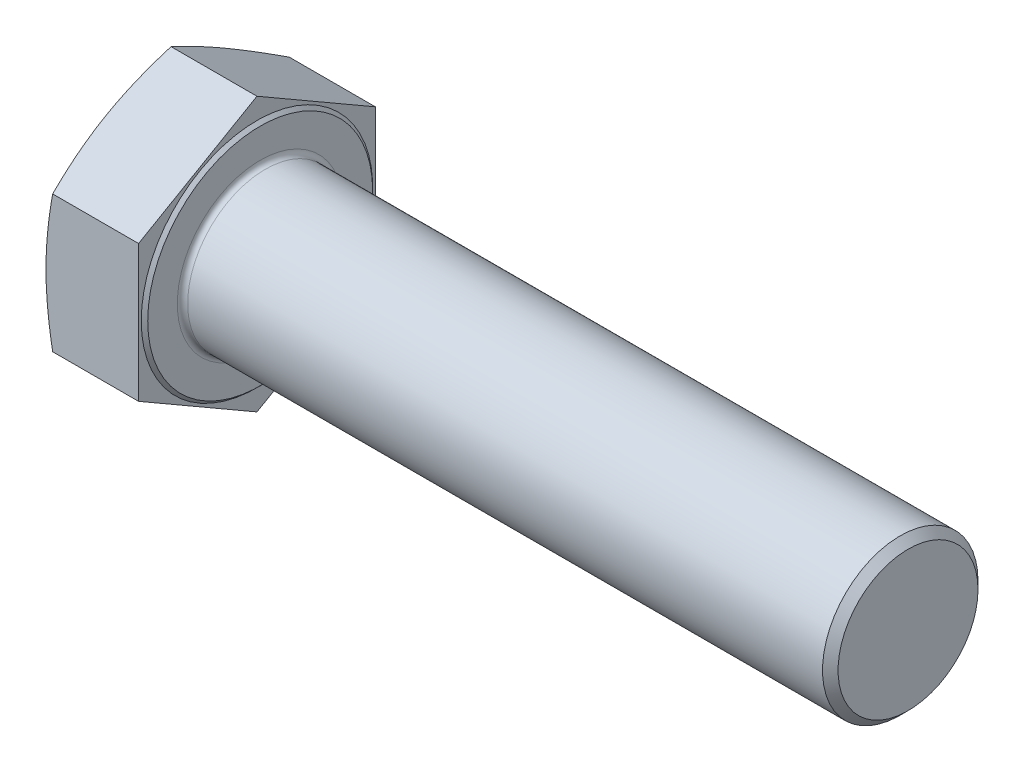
SolidWorks part; units mm, degrees
ref_plane "Front" through (0, 0, 0) normal (0, 0, 1) x (1, 0, 0)
ref_plane "Top" through (0, 0, 0) normal (0, 1, 0) x (1, 0, 0)
ref_plane "Right" through (0, 0, 0) normal (1, 0, 0) x (0, 0, -1)
sketch "Sketch2" plane through (0, 0, 0) normal (1, 0, 0) x (0, 0, -1)
  line L1 (0, -42.2043) -> (36.55, -21.1022)
  line L2 (36.55, -21.1022) -> (36.55, 21.1022)
  line L3 (36.55, 21.1022) -> (0, 42.2043)
  line L4 (0, 42.2043) -> (-36.55, 21.1022)
  line L5 (-36.55, 21.1022) -> (-36.55, -21.1022)
  line L6 (-36.55, -21.1022) -> (0, -42.2043)
  circle A0 centre (0, 0) radius 36.55 construction
  dimension "s" = 73.1
extrude "BaseHead" add sketch "Sketch2" along normal blind 29.58
sketch "Sketch3" plane through (0, 0, 0) normal (0, 0, 1) x (1, 0, 0)
  line L0 (29.58, 42.2043) -> (29.58, 34.725)
  line L2 (29.58, 34.725) -> (28.58, 35.725)
  line L3 (28.58, 35.725) -> (28.58, 42.2043)
  line L5 (28.58, 42.2043) -> (29.58, 42.2043)
  line L6 (-0.9571, 0) -> (7.6478, 0) construction
  line L7 (29.58, 42.2043) -> (0, 42.2043) construction
  dimension "D1" = 45
  dimension "c" = 1
  dimension "dw" = 69.45
revolve "BearingFace" cut sketch "Sketch3" angle 360 about L6
sketch "Sketch4" plane through (0, 0, 0) normal (0, 0, 1) x (1, 0, 0)
  line L0 (-0.4935, 0) -> (3.5626, 0) construction
  line L2 (0, 42.2043) -> (2.058, 42.2043)
  line L4 (2.058, 42.2043) -> (0, 36.55)
  line L6 (0, 36.55) -> (0, 42.2043)
  line L7 (28.58, 42.2043) -> (0, 42.2043) construction
  dimension "D1" = 20
  dimension "D2" = 73.1
revolve "HeadChamfer" cut sketch "Sketch4" angle 360 about L0
ref_plane "Plane1" through (121.58, 0, 0) normal (1, 0, 0) x (0, 0, -1)
sketch "Sketch5" plane through (29.58, 0, 0) normal (1, 0, 0) x (0, 0, -1)
  circle A0 centre (0, 0) radius 24
  dimension "d" = 48
extrude "BaseBody" add sketch "Sketch5" along normal blind 200
chamfer "Chamfer1" distance 2.4 angle 45 1 edges at (229.58, 0, -24)
fillet "HeadFillet" radius 1.6 1 edges at (29.58, 0, -24)
equation "\"D2@Sketch4\" = \"s@Sketch2\""
equation "\"b@ThreadCosmetic1\" = \"l@BaseBody\" - \"lg@Plane1\""
equation "\"D1@Chamfer1\" = 0.05 * \"d@Sketch5\""
